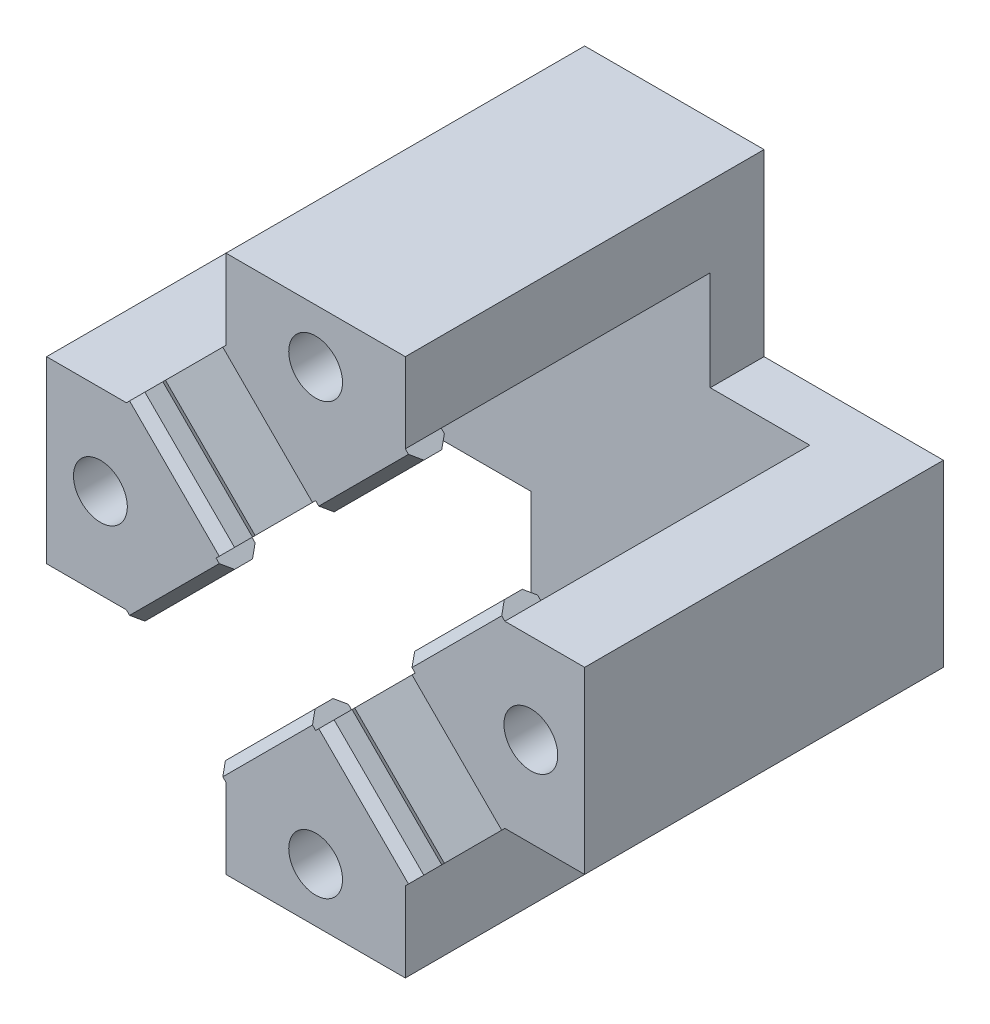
SolidWorks part; units mm, degrees
ref_plane "Plan de face" through (0, 0, 0) normal (0, 0, 1) x (1, 0, 0)
ref_plane "Plan de dessus" through (0, 0, 0) normal (0, 1, 0) x (1, 0, 0)
ref_plane "Plan de droite" through (0, 0, 0) normal (1, 0, 0) x (0, 0, -1)
sketch "Esquisse1" plane through (0, 0, 0) normal (0, 0, 1) x (1, 0, 0)
  line L1 (-5.269, 9.0535) -> (4.731, 9.0535)
  line L2 (-5.269, 9.0535) -> (-5.269, -20.9465)
  line L3 (-5.269, -20.9465) -> (4.731, -20.9465)
  line L4 (4.731, 9.0535) -> (4.731, -20.9465)
  line L5 (-15.269, -0.9465) -> (14.731, -0.9465)
  line L6 (-15.269, -0.9465) -> (-15.269, -10.9465)
  line L7 (-15.269, -10.9465) -> (14.731, -10.9465)
  line L8 (14.731, -0.9465) -> (14.731, -10.9465)
  point P8 (-15.269, -5.9465)
  point P9 (-5.269, -5.9465)
  dimension "D1" = 10
  dimension "D2" = 30
  dimension "D3" = 10
  dimension "D4" = 30
  dimension "D5" = 10
  dimension "D6" = 0
extrude "Boss.-Extru.1" add sketch "Esquisse1" along normal blind 3 contours L2 L7 L4 L5 | L6 L7 L2 L5 | L2 L5 L4 L1 | L8 L5 L4 L7 | L7 L2 L3 L4
sketch "Esquisse2" plane through (0, 0, 3) normal (0, 0, 1) x (1, 0, 0)
  line L0 (-5.269, 4.6035) -> (-0.269, -0.3965)
  line L1 (-5.269, 9.0535) -> (4.731, 9.0535)
  line L2 (-5.269, 9.0535) -> (-5.269, 4.6035)
  line L3 (-0.269, -0.3965) -> (4.731, 4.6035)
  line L4 (4.731, 9.0535) -> (4.731, 4.6035)
  line L5 (-15.269, -5.9465) -> (14.731, -5.9465) construction
  line L8 (-0.269, 9.0535) -> (-0.269, -20.9465) construction
  line L10 (4.731, -20.9465) -> (4.731, -16.4965)
  line L11 (-0.269, -11.4965) -> (4.731, -16.4965)
  line L12 (-5.269, -20.9465) -> (-5.269, -16.4965)
  line L13 (-5.269, -20.9465) -> (4.731, -20.9465)
  line L14 (-5.269, -16.4965) -> (-0.269, -11.4965)
  line L15 (-10.819, -0.9465) -> (-5.819, -5.9465)
  line L16 (-15.269, -0.9465) -> (-10.819, -0.9465)
  line L17 (-15.269, -0.9465) -> (-15.269, -10.9465)
  line L18 (-15.269, -10.9465) -> (-10.819, -10.9465)
  line L19 (-5.819, -5.9465) -> (-10.819, -10.9465)
  line L20 (5.281, -5.9465) -> (10.281, -10.9465)
  line L21 (14.731, -10.9465) -> (10.281, -10.9465)
  line L22 (14.731, -0.9465) -> (14.731, -10.9465)
  line L23 (14.731, -0.9465) -> (10.281, -0.9465)
  line L24 (10.281, -0.9465) -> (5.281, -5.9465)
  dimension "D1" = 135
  dimension "D2" = 135
  dimension "D3" = 0
  dimension "D4" = 9.45
  dimension "D5" = 0
  dimension "D6" = 135
  dimension "D7" = 135
  dimension "D8" = 9.45
extrude "Boss.-Extru.2" add sketch "Esquisse2" along normal blind 17
sketch "Esquisse3" plane through (0, 0, 0) normal (0, 0, -1) x (-1, 0, 0)
  line L1 (5.269, 9.0535) -> (-4.731, 9.0535) construction
  line L2 (-14.731, -0.9465) -> (-14.731, -10.9465) construction
  line L3 (15.269, -0.9465) -> (15.269, -10.9465) construction
  line L4 (5.269, -20.9465) -> (-4.731, -20.9465) construction
  circle A0 centre (0.269, 6.0535) radius 1.5
  circle A1 centre (-11.731, -5.9465) radius 1.5
  circle A2 centre (12.269, -5.9465) radius 1.5
  circle A3 centre (0.269, -17.9465) radius 1.5
  point P16 (0.269, -20.9465)
  dimension "D2" = 3
  dimension "D3" = 3
  dimension "D4" = 3
  dimension "D5" = 3
  dimension "D6" = 3
  dimension "D7" = 3
  dimension "D8" = 3
  dimension "D1" = 3
extrude "Enlèv. mat.-Extru.1" cut sketch "Esquisse3" against normal through all both and the other way through all
sketch "Esquisse4" plane through (-0.3328, -0.3328, 0) normal (-0.7071, -0.7071, 0) x (0, 0, 1)
  line L0 (20, -0.0902) -> (3, -0.0902) construction
  line L1 (20, 6.9809) -> (18, 6.9809)
  line L2 (20, 6.9809) -> (20, -0.0902)
  line L3 (20, -0.0902) -> (18, -0.0902)
  line L4 (18, 6.9809) -> (18, -0.0902)
  line L5 (20, -7.9391) -> (3, -7.9391) construction
  line L6 (20, -15.0101) -> (18, -15.0101)
  line L7 (20, -15.0101) -> (20, -7.9391)
  line L8 (20, -7.9391) -> (18, -7.9391)
  line L9 (18, -15.0101) -> (18, -7.9391)
  dimension "D1" = 2
  dimension "D2" = 2
extrude "Boss.-Extru.3" add sketch "Esquisse4" along normal blind 0.75
sketch "Esquisse5" plane through (-5.8828, -5.8828, 0) normal (0.7071, 0.7071, 0) x (0, 0, -1)
  line L0 (-20, 6.9809) -> (-3, 6.9809) construction
  line L1 (-20, -0.0902) -> (-18, -0.0902)
  line L2 (-20, -0.0902) -> (-20, 6.9809)
  line L3 (-20, 6.9809) -> (-18, 6.9809)
  line L4 (-18, -0.0902) -> (-18, 6.9809)
  line L5 (-20, -15.0101) -> (-3, -15.0101) construction
  line L6 (-20, -7.9391) -> (-18, -7.9391)
  line L7 (-20, -7.9391) -> (-20, -15.0101)
  line L8 (-20, -15.0101) -> (-18, -15.0101)
  line L9 (-18, -7.9391) -> (-18, -15.0101)
  dimension "D1" = 2
  dimension "D2" = 2
extrude "Boss.-Extru.4" add sketch "Esquisse5" along normal blind 0.75
sketch "Esquisse6" plane through (5.6138, -5.6138, 0) normal (-0.7071, 0.7071, 0) x (0, 0, 1)
  line L0 (18, -8.3195) -> (3, -8.3195) construction
  line L1 (20, -15.3906) -> (18, -15.3906)
  line L2 (20, -15.3906) -> (20, -8.3195)
  line L3 (20, -8.3195) -> (18, -8.3195)
  line L4 (18, -15.3906) -> (18, -8.3195)
  line L5 (18, -0.4706) -> (3, -0.4706) construction
  line L6 (20, 6.6005) -> (18, 6.6005)
  line L7 (20, 6.6005) -> (20, -0.4706)
  line L8 (20, -0.4706) -> (18, -0.4706)
  line L9 (18, 6.6005) -> (18, -0.4706)
  dimension "D1" = 2
  dimension "D2" = 2
extrude "Boss.-Extru.5" add sketch "Esquisse6" along normal blind 0.75
sketch "Esquisse7" plane through (0.0638, -0.0638, 0) normal (0.7071, -0.7071, 0) x (0, 0, -1)
  line L0 (-18, -8.3195) -> (-3, -8.3195) construction
  line L1 (-20, -15.3906) -> (-18, -15.3906)
  line L2 (-20, -15.3906) -> (-20, -8.3195)
  line L3 (-20, -8.3195) -> (-18, -8.3195)
  line L4 (-18, -15.3906) -> (-18, -8.3195)
  line L5 (-18, -0.4706) -> (-3, -0.4706) construction
  line L6 (-20, 6.6005) -> (-18, 6.6005)
  line L7 (-20, 6.6005) -> (-20, -0.4706)
  line L8 (-20, -0.4706) -> (-18, -0.4706)
  line L9 (-18, 6.6005) -> (-18, -0.4706)
  dimension "D1" = 2
  dimension "D2" = 2
extrude "Boss.-Extru.6" add sketch "Esquisse7" along normal blind 0.75
chamfer "Chanfrein1" distance 0.5 angle 45 16 edges at (-3.2993, -13.4662, 18) (-3.2993, -13.4662, 20) (7.2507, -2.9162, 20) (7.2507, -2.9162, 18) (-7.7887, -8.9769, 18) (-7.7887, -8.9769, 20) (-7.7887, -2.9162, 18) (-7.7887, -2.9162, 20) (-3.2993, 1.5731, 18) (-3.2993, 1.5731, 20) (2.7613, 1.5731, 20) (2.7613, 1.5731, 18) (7.2507, -8.9769, 18) (7.2507, -8.9769, 20) (2.7613, -13.4662, 20) (2.7613, -13.4662, 18)
